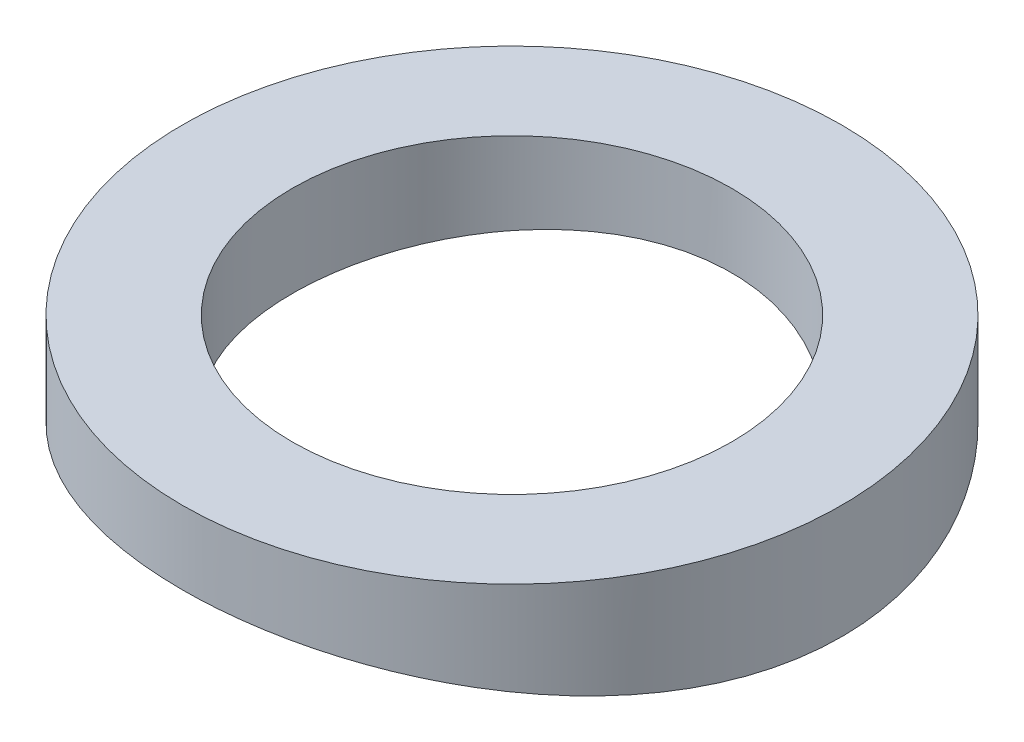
SolidWorks part; units mm, degrees
ref_plane "Plan de face" through (0, 0, 0) normal (0, 0, 1) x (1, 0, 0)
ref_plane "Plan de dessus" through (0, 0, 0) normal (0, 1, 0) x (1, 0, 0)
ref_plane "Plan de droite" through (0, 0, 0) normal (1, 0, 0) x (0, 0, -1)
sketch "Esquisse1" plane through (0, 0, 0) normal (0, 0, 1) x (1, 0, 0)
  line L0 (0, 6.5369) -> (0, -10.1626) construction
  line L1 (-9, 0.8887) -> (0, 0.8887)
  line L2 (-9, 0.8887) -> (-9, -3.1113)
  line L3 (-9, -3.1113) -> (0, -3.1113)
  line L4 (0, -3.1113) -> (0, 0.8887)
  dimension "D1" = 9
  dimension "D2" = 4
revolve "Révolution1" add sketch "Esquisse1" angle 360 about L0
sketch "Esquisse2" plane through (0, 0, 0) normal (0, 0, 1) x (1, 0, 0)
  line L0 (9, 0.8887) -> (-9, 0.8887) construction
  circle A0 centre (0, -38.1113) radius 37
  dimension "D1" = 39
  dimension "D2" = 74
extrude "Extrusion1" cut sketch "Esquisse2" against normal through all and the other way through all
sketch "Esquisse3" plane through (0, 0.8887, 0) normal (0, 1, 0) x (1, 0, 0)
  circle A0 centre (0, 0) radius 6
  dimension "D1" = 12
extrude "Extrusion2" cut sketch "Esquisse3" against normal through all
